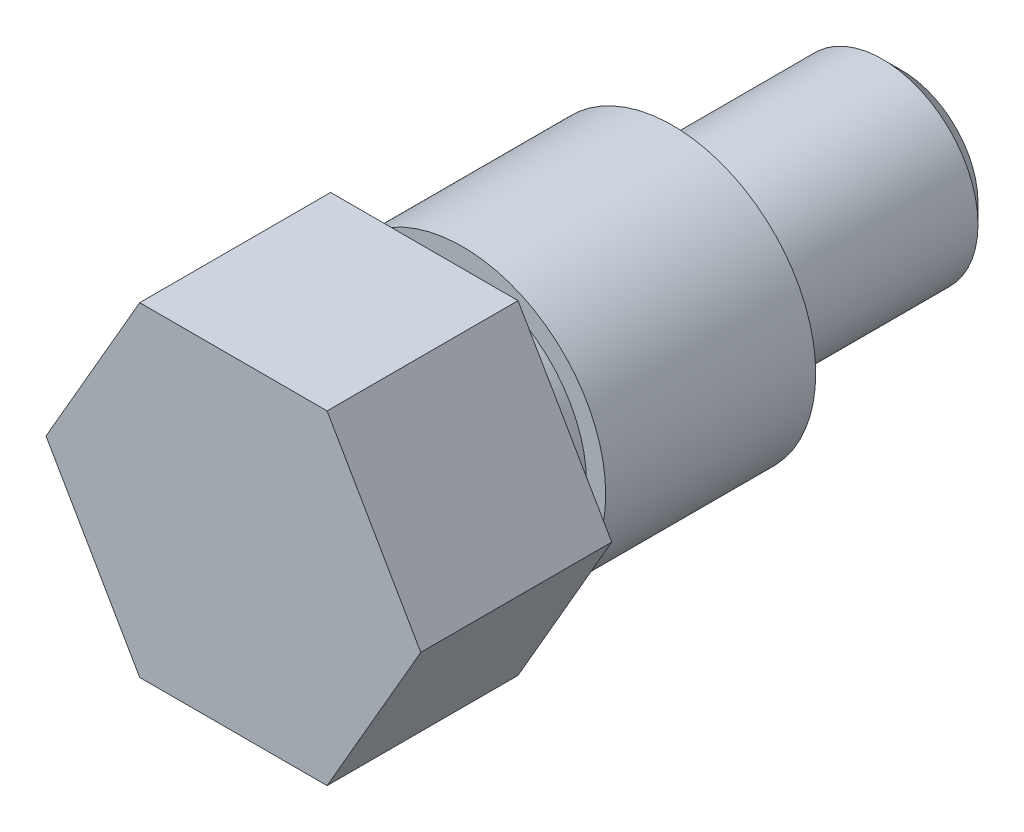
SolidWorks part; units mm, degrees
ref_plane "Plan de face" through (0, 0, 0) normal (0, 0, 1) x (1, 0, 0)
ref_plane "Plan de dessus" through (0, 0, 0) normal (0, 1, 0) x (1, 0, 0)
ref_plane "Plan de droite" through (0, 0, 0) normal (1, 0, 0) x (0, 0, -1)
sketch "Esquisse1" plane through (0, 0, 0) normal (0, 0, 1) x (1, 0, 0)
  line L0 (-4.9075, 8.5) -> (4.9075, 8.5)
  line L1 (9.815, 0) -> (4.9075, -8.5)
  line L10 (-9.815, 0) -> (-4.9075, 8.5)
  line L13 (-4.9075, -8.5) -> (-9.815, 0)
  line L14 (4.9075, -8.5) -> (-4.9075, -8.5)
  line L15 (4.9075, 8.5) -> (9.815, 0)
  dimension "D3" = 17
  dimension "D4" = 17
extrude "Extrusion1" add sketch "Esquisse1" against normal blind 35
ref_plane "Plan1" through (0, 0, -10) normal (0, 0, 1) x (1, 0, 0)
sketch "Esquisse2" plane through (0, 0, -10) normal (0, 0, 1) x (1, 0, 0)
  circle A0 centre (0, 0) radius 7.5
  dimension "D1" = 15
extrude "Enlèv. mat.-Extru.1" cut sketch "Esquisse2" against normal blind 13 flip side to cut
ref_plane "Plan2" through (0, 0, -23) normal (0, 0, 1) x (1, 0, 0)
sketch "Esquisse3" plane through (0, 0, -23) normal (0, 0, 1) x (1, 0, 0)
  circle A0 centre (0, 0) radius 5
  dimension "D1" = 10
extrude "Enlèv. mat.-Extru.2" cut sketch "Esquisse3" against normal blind 15 flip side to cut
sketch "Esquisse4" plane through (0, 0, -10) normal (0, 0, 1) x (1, 0, 0)
  circle A0 centre (0, 0) radius 6.5
  dimension "D1" = 13
extrude "Enlèv. mat.-Extru.4" cut sketch "Esquisse4" against normal blind 2 flip side to cut
chamfer "Chanfrein1" distance 1 angle 45 1 edges at (5, 0, -35)
sketch "Esquisse5" plane through (0, 0, 0) normal (0, 1, 0) x (1, 0, 0)
  line L1 (7.5, 23) -> (3.5, 23)
  line L2 (7.5, 23) -> (7.5, 24.5)
  line L3 (7.5, 24.5) -> (3.5, 24.5)
  line L4 (3.5, 23) -> (3.5, 24.5)
  dimension "D1" = 3.5
  dimension "D2" = 1.5
revolve "Enlèvement de matière-Révolution1" cut sketch "Esquisse5" angle 360 about axis through (0, 0, -23) along (0, 0, 1)
